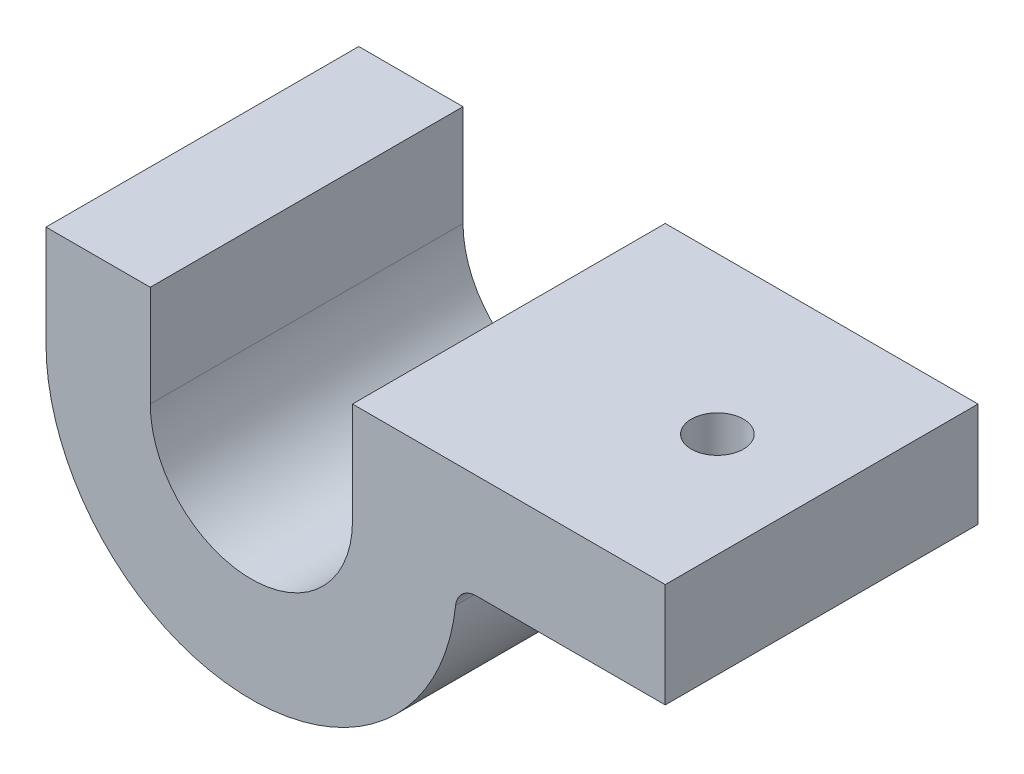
SolidWorks part; units mm, degrees
ref_plane "Front Plane" through (0, 0, 0) normal (0, 0, 1) x (1, 0, 0)
ref_plane "Top Plane" through (0, 0, 0) normal (0, 1, 0) x (1, 0, 0)
ref_plane "Right Plane" through (0, 0, 0) normal (1, 0, 0) x (0, 0, -1)
sketch "Sketch1" plane through (0, 0, 0) normal (0, 0, 1) x (1, 0, 0)
  line L0 (-9.85, 4.85) -> (-9.85, 0)
  line L1 (-4.85, 4.85) -> (-4.85, 0)
  line L2 (4.85, 4.85) -> (4.85, 0)
  line L3 (4.85, 4.85) -> (19.85, 4.85)
  line L4 (9.8489, -0.15) -> (9.8489, -0.15)
  line L5 (9.8489, -0.15) -> (19.85, -0.15)
  line L6 (-9.85, 4.85) -> (-4.85, 4.85)
  line L7 (19.85, 4.85) -> (19.85, -0.15)
  arc A0 (-4.85, 0) -> (4.85, 0) centre (0, 0) ccw
  arc A1 (-9.85, 0) -> (9.8489, -0.15) centre (0, 0) ccw
  dimension "D1" = 9.7
  dimension "D2" = 15
  dimension "D3" = 5
extrude "Boss-Extrude1" add sketch "Sketch1" against normal blind 15
sketch "Sketch2" plane through (0, -0.15, 0) normal (0, -1, 0) x (1, 0, 0)
  line L0 (9.8489, 0) -> (19.85, 0) construction
  circle A0 centre (14.8494, -7.5) radius 1.25
  point P2 (0, 0)
  point P5 (14.8494, 0)
  dimension "D1" = 2.5
extrude "Cut-Extrude1" cut sketch "Sketch2" against normal blind 15
fillet "Fillet1" radius 1 1 edges at (9.8489, -0.15, -7.5)
